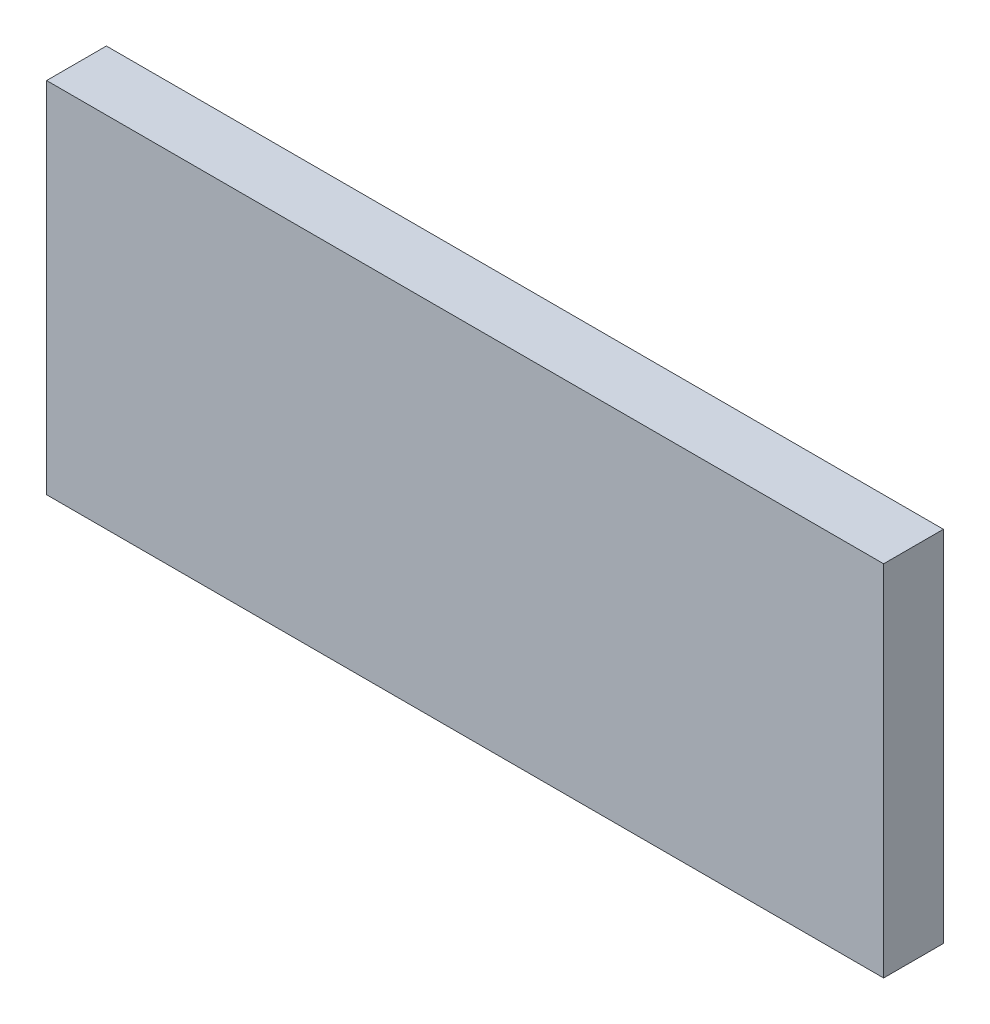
SolidWorks part; units mm, degrees
ref_plane "Front" through (0, 0, 0) normal (0, 0, 1) x (1, 0, 0)
ref_plane "Top" through (0, 0, 0) normal (0, 1, 0) x (1, 0, 0)
ref_plane "Right" through (0, 0, 0) normal (1, 0, 0) x (0, 0, -1)
sketch "Sketch1" plane through (0, 0, 0) normal (0, 0, 1) x (1, 0, 0)
  line L1 (0, 0) -> (177.8, 0)
  line L2 (0, 0) -> (0, 76.2)
  line L3 (0, 76.2) -> (177.8, 76.2)
  line L4 (177.8, 0) -> (177.8, 76.2)
  dimension "D1" = 177.8
  dimension "D2" = 76.2
extrude "Extrude1" add sketch "Sketch1" along normal blind 12.7
